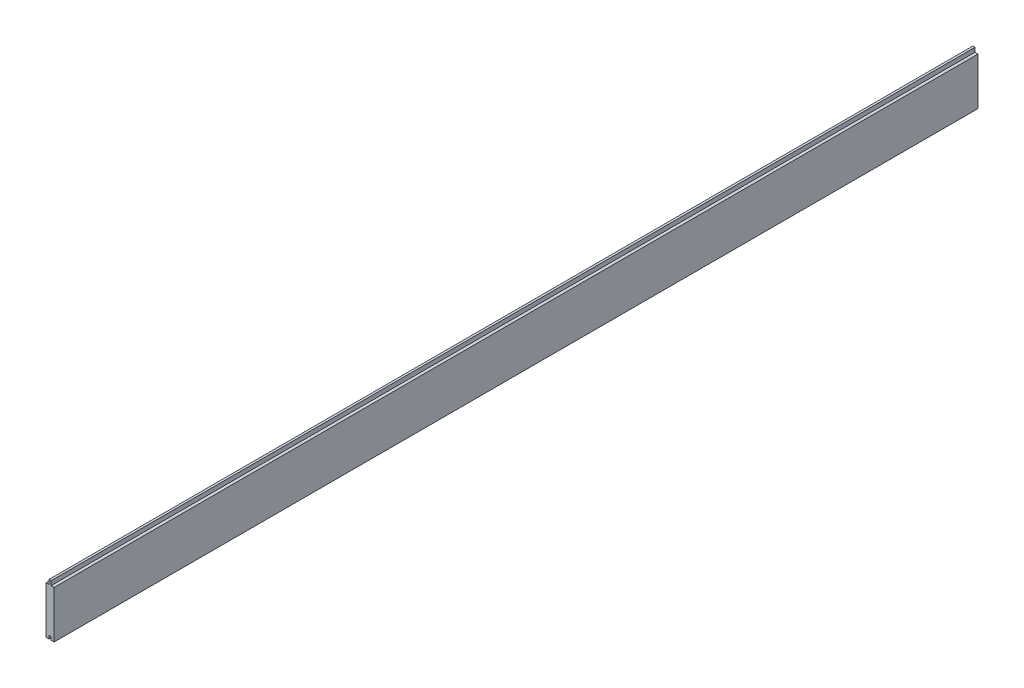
SolidWorks part; units mm, degrees
ref_plane "Plan de face" through (0, 0, 0) normal (0, 0, 1) x (1, 0, 0)
ref_plane "Plan de dessus" through (0, 0, 0) normal (0, 1, 0) x (1, 0, 0)
ref_plane "Plan de droite" through (0, 0, 0) normal (1, 0, 0) x (0, 0, -1)
sketch "Esquisse1" plane through (0, 0, 0) normal (0, 0, 1) x (1, 0, 0)
  line L1 (-7.5, 43.5) -> (7.5, 43.5)
  line L2 (-7.5, 43.5) -> (-7.5, -43.5)
  line L3 (-7.5, -43.5) -> (7.5, -43.5)
  line L4 (7.5, 43.5) -> (7.5, -43.5)
  line L5 (-7.5, 43.5) -> (7.5, -43.5) construction
  line L6 (-7.5, -43.5) -> (7.5, 43.5) construction
  line L7 (-2, 51.5) -> (2, 51.5)
  line L8 (-2, 51.5) -> (-2, 35.5)
  line L9 (-2, 35.5) -> (2, 35.5)
  line L10 (2, 51.5) -> (2, 35.5)
  line L11 (-2, 51.5) -> (2, 35.5) construction
  line L12 (-2, 35.5) -> (2, 51.5) construction
  line L13 (-2, -37.5) -> (2, -37.5)
  line L14 (-2, -37.5) -> (-2, -49.5)
  line L15 (-2, -49.5) -> (2, -49.5)
  line L16 (2, -37.5) -> (2, -49.5)
  line L17 (-2, -37.5) -> (2, -49.5) construction
  line L18 (-2, -49.5) -> (2, -37.5) construction
  point P0 (0, 0)
  point P5 (0, 43.5)
  point P11 (0, -43.5)
  dimension "D1" = 15
  dimension "D2" = 87
  dimension "D3" = 4
  dimension "D4" = 16
  dimension "D5" = 4
  dimension "D6" = 12
extrude "Boss.-Extru.1" add sketch "Esquisse1" along normal blind 1700 contours L13 L16 L3 L4 L1 L10 L9 L8 L2 L14 | L10 L7 L8 L1 | L10 L1 L8 L9
